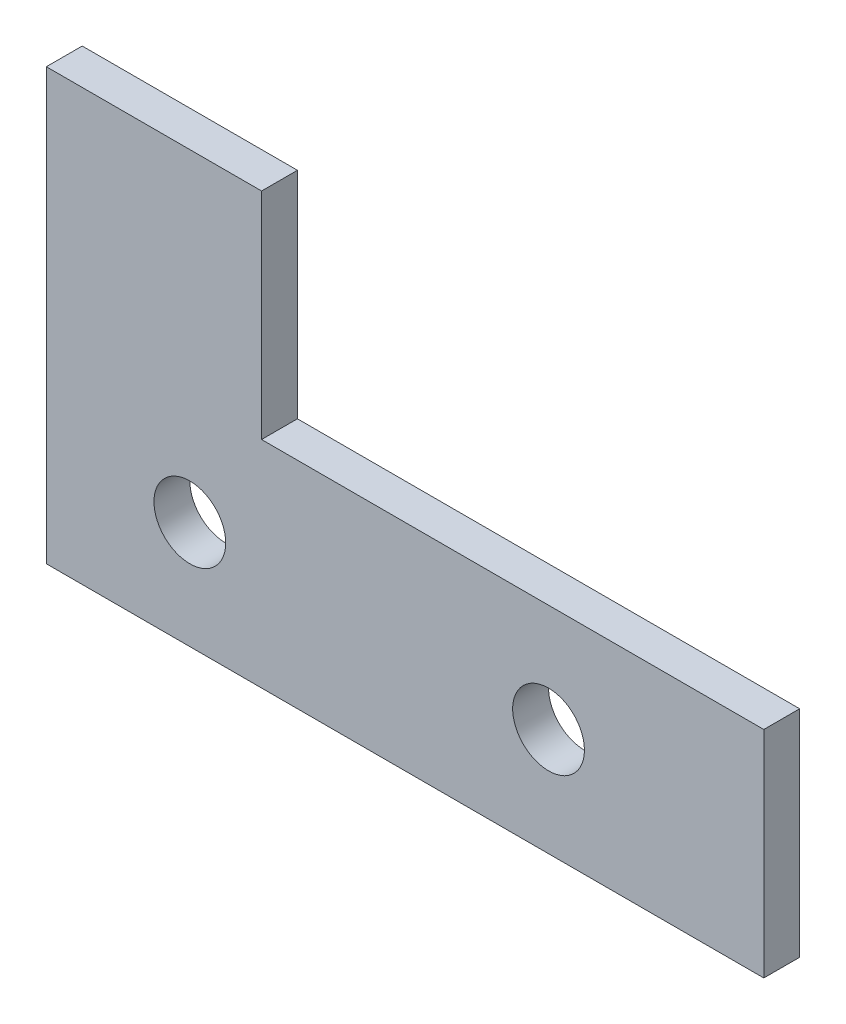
SolidWorks part; units mm, degrees
ref_plane "Front" through (0, 0, 0) normal (0, 0, 1) x (1, 0, 0)
ref_plane "Top" through (0, 0, 0) normal (0, 1, 0) x (1, 0, 0)
ref_plane "Right" through (0, 0, 0) normal (1, 0, 0) x (0, 0, -1)
sketch "Sketch1" plane through (0, 0, 0) normal (0, 0, 1) x (1, 0, 0)
  line L3 (38.1, 38.1) -> (127, 38.1)
  line L4 (127, 0) -> (127, 38.1)
  line L5 (0, 0) -> (127, 0)
  line L6 (0, 0) -> (0, 76.2)
  line L7 (0, 76.2) -> (38.1, 76.2)
  line L8 (38.1, 38.1) -> (38.1, 76.2)
  circle A0 centre (25.4, 19.05) radius 6.35
  circle A1 centre (88.9, 19.05) radius 6.35
  dimension "D3" = 12.7
  dimension "D6" = 19.05
  dimension "D8" = 63.5
  dimension "D1" = 76.2
  dimension "D2" = 127
  dimension "D4" = 38.1
  dimension "D5" = 38.1
  dimension "D7" = 25.4
extrude "Base-Extrude" add sketch "Sketch1" along normal blind 6.35
